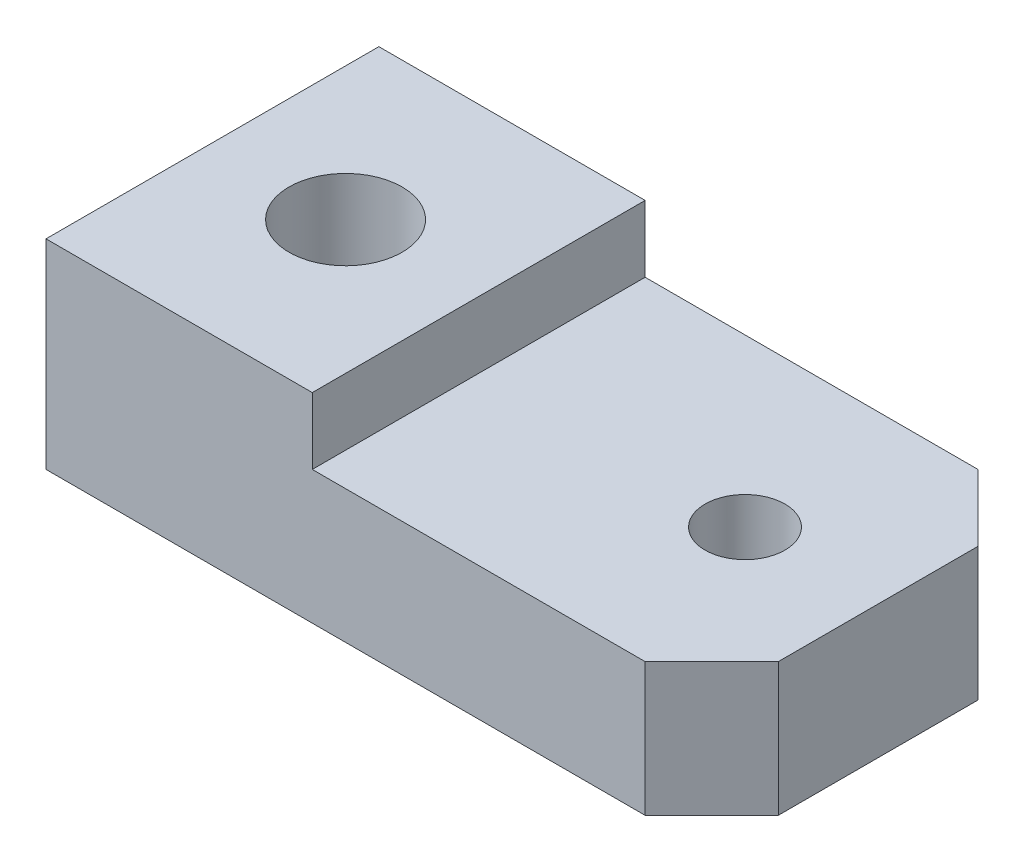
SolidWorks part; units mm, degrees
ref_plane "Plan1" through (0, 0, 0) normal (0, 0, 1) x (1, 0, 0)
ref_plane "Plan2" through (0, 0, 0) normal (0, 1, 0) x (1, 0, 0)
ref_plane "Plan3" through (0, 0, 0) normal (1, 0, 0) x (0, 0, -1)
sketch "Esquisse1" plane through (0, 0, 0) normal (0, 0, 1) x (1, 0, 0)
  line L0 (-50, 0) -> (0, 0)
  line L1 (0, 0) -> (0, 10)
  line L2 (0, 10) -> (-30, 10)
  line L3 (-30, 10) -> (-30, 15)
  line L4 (-30, 15) -> (-50, 15)
  line L5 (-50, 15) -> (-50, 0)
  dimension "D1" = 20
  dimension "D2" = 30
  dimension "D3" = 10
  dimension "D4" = 15
extrude "Base-Extrusion" add sketch "Esquisse1" along normal blind 25
hole_wizard "Perçage1" positions "Esquisse3" profile "Esquisse2" hole size "M8" standard "ISO"
sketch "Esquisse3" plane through (0, 0, 0) normal (0, -1, 0) x (1, 0, 0)
  line L0 (-50, 25) -> (0, 25) construction
  line L1 (-50, 25) -> (-50, 0) construction
  point P0 (-40, 12.5)
  dimension "D1" = 12.5
  dimension "D2" = 10
sketch "Esquisse2" plane through (-40, 0, 12.5) normal (1, 0, 0) x (0, 0, -1)
  line L0 (0, 0) -> (0, 15)
  line L1 (0, 15) -> (4.25, 15)
  line L2 (4.25, 15) -> (4.25, 0)
  line L5 (4.25, 0) -> (0, 0)
  line L11 (0, -6.35) -> (0, 107.95) construction
  dimension "Diamètre du perçage jusqu'au prochain" = 8.5
  dimension "Profondeur du perçage jusqu'au prochain" = 15
hole_wizard "Perçage2" positions "Esquisse5" profile "Esquisse4" tap size "M6x1.0" standard "Ansi Métrique"
sketch "Esquisse5" plane through (0, 0, 0) normal (0, -1, 0) x (1, 0, 0)
  line L0 (-50, 25) -> (0, 25) construction
  line L1 (0, 25) -> (0, 0) construction
  point P0 (-10, 12.5)
  dimension "D1" = 12.5
  dimension "D2" = 10
sketch "Esquisse4" plane through (-10, 0, 12.5) normal (1, 0, 0) x (0, 0, -1)
  line L0 (0, 0) -> (0, 15)
  line L1 (0, 15) -> (2.5, 15)
  line L3 (2.5, 15) -> (2.5, 12)
  line L4 (2.5, 12) -> (3, 12)
  line L5 (3, 12) -> (3, 0)
  line L7 (3, 0) -> (0, 0)
  line L11 (0, -6.35) -> (0, 107.95) construction
  dimension "Diamètre du trou pour taraudage jusqu'au prochain" = 5
  dimension "Profondeur du trou pour taraudage jusqu'au prochain" = 15
  dimension "Diamètre du filetage" = 6
  dimension "Profondeur du filetage" = 12
chamfer "Chanfrein1" distance 5 angle 45
